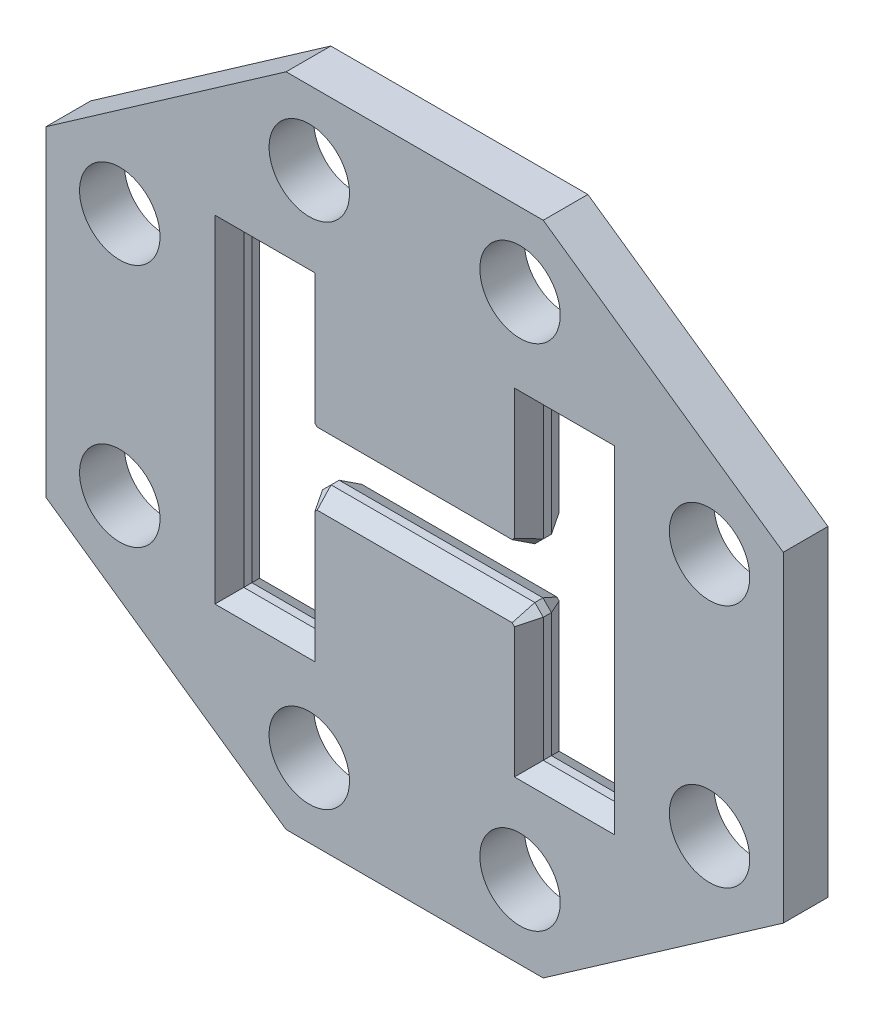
SolidWorks part; units mm, degrees
ref_plane "Front Plane" through (0, 0, 0) normal (1, 0, 0) x (0, 1, 0)
ref_plane "Top Plane" through (0, 0, 0) normal (0, 0, 1) x (0, 1, 0)
ref_plane "Right Plane" through (0, 0, 0) normal (0, 1, 0) x (-1, 0, 0)
sketch "sk W14x730" plane through (0, 0, 0) normal (0, 0, 1) x (0, 1, 0)
  point P0 (0, -284.734)
  point P1 (-38.989, 0)
  line B0 (-227.203, -284.734) -> (-227.203, -160.02)
  line B1 (-227.203, -160.02) -> (-54.229, -160.02)
  line B2 (-38.989, -144.78) -> (-38.989, 144.78)
  line B3 (-54.229, 160.02) -> (-227.203, 160.02)
  line B4 (-227.203, 160.02) -> (-227.203, 284.734)
  line B5 (-227.203, 284.734) -> (227.203, 284.734)
  line B6 (227.203, 284.734) -> (227.203, 160.02)
  line B7 (227.203, 160.02) -> (54.229, 160.02)
  line B8 (38.989, 144.78) -> (38.989, -144.78)
  line B9 (54.229, -160.02) -> (227.203, -160.02)
  line B10 (227.203, -160.02) -> (227.203, -284.734)
  line B11 (227.203, -284.734) -> (-227.203, -284.734)
  arc B12 (-54.229, -160.02) -> (-38.989, -144.78) centre (-54.229, -144.78) ccw
  arc B13 (-38.989, 144.78) -> (-54.229, 160.02) centre (-54.229, 144.78) ccw
  arc B14 (54.229, 160.02) -> (38.989, 144.78) centre (54.229, 144.78) ccw
  arc B15 (38.989, -144.78) -> (54.229, -160.02) centre (54.229, -144.78) ccw
sketch_block_instance "W14x730-113"
sketch_block "W14x730" parameters "D4"=15.24, "D1"=454.406, "D2"=569.468, "D3"=77.978, "D5"=124.714
sketch_block_instance "W14x730-232"
sketch_block_instance "W14x730-233"
sketch_block_instance "W14x730-234"
sketch_block_instance "W14x730-276"
sketch_block_instance "W14x730-277"
sketch_block_instance "W14x730-278"
sketch_block_instance "W14x730-279"
sketch_block_instance "W14x730-280"
sketch_block_instance "W14x730-281"
sketch_block_instance "W14x730-282"
sketch_block_instance "W14x730-283"
sketch_block_instance "W14x730-284"
sketch_block_instance "W14x730-285"
sketch_block_instance "W14x730-286"
sketch_block_instance "W14x730-287"
sketch_block_instance "W14x730-288"
sketch_block_instance "W14x730-289"
sketch_block_instance "W14x730-321"
sketch_block_instance "W14x730-322"
sketch_block_instance "W14x730-323"
sketch_block_instance "W14x730-324"
sketch_block_instance "W14x730-325"
sketch_block_instance "W14x730-326"
sketch_block_instance "W14x730-327"
sketch_block_instance "W14x730-328"
sketch_block_instance "W14x730-329"
sketch_block_instance "W14x730-330"
sketch_block_instance "W14x730-331"
sketch_block_instance "W14x730-332"
sketch_block_instance "W14x730-333"
sketch_block_instance "W14x730-334"
sketch_block_instance "W14x730-335"
sketch_block_instance "W14x730-336"
sketch_block_instance "W14x730-337"
sketch_block_instance "W14x730-338"
sketch_block_instance "W14x730-339"
sketch_block_instance "W14x730-340"
sketch_block_instance "W14x730-341"
sketch_block_instance "W14x730-365"
sketch_block_instance "W14x730-366"
sketch_block_instance "W14x730-367"
sketch_block_instance "W14x730-368"
sketch_block_instance "W14x730-369"
sketch_block_instance "W14x730-370"
sketch_block_instance "W14x730-371"
sketch_block_instance "W14x730-372"
sketch_block_instance "W14x730-373"
sketch_block_instance "W14x730-374"
sketch_block_instance "W14x730-375"
sketch_block_instance "W14x730-376"
sketch_block_instance "W14x730-377"
sketch_block_instance "W14x730-378"
sketch_block_instance "W14x730-379"
sketch_block_instance "W14x730-380"
sketch_block_instance "W14x730-381"
sketch_block_instance "W14x730-382"
sketch_block_instance "W14x730-383"
sketch_block_instance "W14x730-384"
sketch_block_instance "W14x730-385"
sketch_block_instance "W14x730-386"
sketch_block_instance "W14x730-387"
sketch_block_instance "W14x730-388"
sketch_block_instance "W14x730-389"
sketch_block_instance "W14x730-390"
sketch_block_instance "W14x730-391"
sketch_block_instance "W14x730-410"
sketch_block_instance "W14x730-411"
sketch_block_instance "W14x730-412"
sketch_block_instance "W14x730-413"
sketch_block_instance "W14x730-414"
sketch_block_instance "W14x730-415"
sketch_block_instance "W14x730-416"
sketch_block_instance "W14x730-417"
sketch_block_instance "W14x730-418"
sketch_block_instance "W14x730-419"
sketch_block_instance "W14x730-420"
sketch_block_instance "W14x730-421"
sketch_block_instance "W14x730-422"
sketch_block_instance "W14x730-423"
sketch_block_instance "W14x730-424"
sketch_block_instance "W14x730-425"
sketch_block_instance "W14x730-426"
sketch_block_instance "W14x730-427"
sketch_block_instance "W14x730-428"
sketch_block_instance "W14x730-429"
sketch_block_instance "W14x730-430"
sketch_block_instance "W14x730-431"
sketch_block_instance "W14x730-432"
sketch_block_instance "W14x730-433"
sketch_block_instance "W14x730-434"
sketch_block_instance "W14x730-435"
sketch_block_instance "W14x730-436"
sketch_block_instance "W14x730-437"
sketch_block_instance "W14x730-438"
sketch_block_instance "W14x730-439"
sketch_block_instance "W14x730-440"
sketch_block_instance "W14x730-443"
sketch_block_instance "W14x730-454"
sketch_block_instance "W14x730-455"
sketch_block_instance "W14x730-456"
sketch_block_instance "W14x730-457"
sketch_block_instance "W14x730-458"
sketch_block_instance "W14x730-459"
sketch_block_instance "W14x730-460"
sketch_block_instance "W14x730-461"
sketch_block_instance "W14x730-462"
sketch_block_instance "W14x730-463"
sketch_block_instance "W14x730-464"
sketch_block_instance "W14x730-465"
sketch_block_instance "W14x730-466"
sketch_block_instance "W14x730-467"
sketch_block_instance "W14x730-468"
sketch_block_instance "W14x730-469"
sketch_block_instance "W14x730-470"
sketch_block_instance "W14x730-471"
sketch_block_instance "W14x730-472"
sketch_block_instance "W14x730-473"
sketch_block_instance "W14x730-474"
sketch_block_instance "W14x730-475"
sketch_block_instance "W14x730-476"
sketch_block_instance "W14x730-477"
sketch_block_instance "W14x730-478"
sketch_block_instance "W14x730-479"
sketch_block_instance "W14x730-480"
sketch_block_instance "W14x730-481"
sketch_block_instance "W14x730-482"
sketch_block_instance "W14x730-483"
sketch_block_instance "W14x730-484"
sketch_block_instance "W14x730-485"
sketch_block_instance "W14x730-486"
sketch_block_instance "W14x730-487"
sketch_block_instance "W14x730-488"
sketch_block_instance "W14x730-489"
sketch_block_instance "W14x730-490" parameters "D1"=817.9177, "D2"=1027.7361, "D3"=0.4058, "D4"=24.0009, "D5"=0.4058, "D6"=533.4, "D7"=27.3509, "D8"=8374.3758, "D9"=3499.6788, "D10"=18059.4
sketch "sk W14x665" plane through (0, 0, 0) normal (0, 0, 1) x (0, 1, 0)
  point P0 (-224.155, -274.828)
  line B0 (-224.155, -274.828) -> (-224.155, -160.02)
  line B1 (-224.155, -160.02) -> (-51.181, -160.02)
  line B2 (-35.941, -144.78) -> (-35.941, 144.78)
  line B3 (-51.181, 160.02) -> (-224.155, 160.02)
  line B4 (-224.155, 160.02) -> (-224.155, 274.828)
  line B5 (-224.155, 274.828) -> (224.155, 274.828)
  line B6 (224.155, 274.828) -> (224.155, 160.02)
  line B7 (224.155, 160.02) -> (51.181, 160.02)
  line B8 (35.941, 144.78) -> (35.941, -144.78)
  line B9 (51.181, -160.02) -> (224.155, -160.02)
  line B10 (224.155, -160.02) -> (224.155, -274.828)
  line B11 (224.155, -274.828) -> (-224.155, -274.828)
  arc B12 (-51.181, -160.02) -> (-35.941, -144.78) centre (-51.181, -144.78) ccw
  arc B13 (-35.941, 144.78) -> (-51.181, 160.02) centre (-51.181, 144.78) ccw
  arc B14 (51.181, 160.02) -> (35.941, 144.78) centre (51.181, 144.78) ccw
  arc B15 (35.941, -144.78) -> (51.181, -160.02) centre (51.181, -144.78) ccw
sketch_block_instance "W14x665-1"
sketch_block "W14x665" parameters "D4"=15.24, "D1"=448.31, "D2"=549.656, "D3"=71.882, "D5"=114.808, "D6"=6.35
sketch "sk 605" plane through (0, 0, 0) normal (0, 0, 1) x (0, 1, 0)
  point P0 (-221.1705, -265.684)
  line B0 (-221.1705, -265.684) -> (-221.1705, -160.02)
  line B1 (-221.1705, -160.02) -> (-48.1965, -160.02)
  line B2 (-32.9565, -144.78) -> (-32.9565, 144.78)
  line B3 (-48.1965, 160.02) -> (-221.1705, 160.02)
  line B4 (-221.1705, 160.02) -> (-221.1705, 265.684)
  line B5 (-221.1705, 265.684) -> (221.1705, 265.684)
  line B6 (221.1705, 265.684) -> (221.1705, 160.02)
  line B7 (221.1705, 160.02) -> (48.1965, 160.02)
  line B8 (32.9565, 144.78) -> (32.9565, -144.78)
  line B9 (48.1965, -160.02) -> (221.1705, -160.02)
  line B10 (221.1705, -160.02) -> (221.1705, -265.684)
  line B11 (221.1705, -265.684) -> (-221.1705, -265.684)
  arc B12 (-48.1965, -160.02) -> (-32.9565, -144.78) centre (-48.1965, -144.78) ccw
  arc B13 (-32.9565, 144.78) -> (-48.1965, 160.02) centre (-48.1965, 144.78) ccw
  arc B14 (48.1965, 160.02) -> (32.9565, 144.78) centre (48.1965, 144.78) ccw
  arc B15 (32.9565, -144.78) -> (48.1965, -160.02) centre (48.1965, -144.78) ccw
sketch_block_instance "w14x605-2"
sketch_block "w14x605" parameters "D4"=15.24, "D1"=442.341, "D2"=531.368, "D3"=65.913, "D5"=105.664, "D6"=6.35
sketch "sk 4\" hex nut Pattern" plane through (0, 0, 0) normal (0, 0, 1) x (0, 1, 0)
  line L7 (419.0803, -173.5887) -> (419.0803, 173.5887)
  line L8 (419.0803, 173.5887) -> (173.5887, 419.0803)
  line L9 (173.5887, 419.0803) -> (-173.5887, 419.0803)
  line L10 (-173.5887, 419.0803) -> (-419.0803, 173.5887)
  line L11 (-419.0803, 173.5887) -> (-419.0803, -173.5887)
  line L12 (-419.0803, -173.5887) -> (-173.5887, -419.0803)
  line L13 (-173.5887, -419.0803) -> (173.5887, -419.0803)
  line L14 (173.5887, -419.0803) -> (419.0803, -173.5887)
  line L29 (54.229, -125.02) -> (262.203, -125.02)
  line L30 (262.203, -125.02) -> (262.203, -319.734)
  line L31 (-262.203, -125.02) -> (-54.229, -125.02)
  line L32 (-262.203, -319.734) -> (-262.203, -125.02)
  line L33 (262.203, -319.734) -> (-262.203, -319.734)
  line L34 (54.229, -125.02) -> (262.203, -125.02)
  line L35 (262.203, -125.02) -> (262.203, -319.734)
  line L36 (-262.203, -125.02) -> (-54.229, -125.02)
  line L37 (-262.203, -319.734) -> (-262.203, -125.02)
  line L38 (262.203, -319.734) -> (-262.203, -319.734)
  line L39 (-419.0803, 173.5887) -> (419.0803, -173.5887)
  line L40 (419.0803, 173.5887) -> (-419.0803, -173.5887)
  line L42 (-466.3243, 523.8553) -> (466.3243, 523.8553)
  line L43 (-466.3243, 523.8553) -> (-466.3243, -523.8553)
  line L44 (262.203, 125.02) -> (54.229, 125.02)
  line L45 (262.203, 319.734) -> (262.203, 125.02)
  line L46 (-262.203, 319.734) -> (262.203, 319.734)
  line L47 (-262.203, 125.02) -> (-262.203, 319.734)
  line L48 (-54.229, 125.02) -> (-262.203, 125.02)
  line L49 (262.203, 125.02) -> (54.229, 125.02)
  line L50 (262.203, 319.734) -> (262.203, 125.02)
  line L51 (-262.203, 319.734) -> (262.203, 319.734)
  line L52 (-262.203, 125.02) -> (-262.203, 319.734)
  line L53 (-54.229, 125.02) -> (-262.203, 125.02)
  line L54 (-466.3243, -523.8553) -> (466.3243, -523.8553)
  line L55 (466.3243, 523.8553) -> (466.3243, -523.8553)
  circle A0 centre (0, 0) radius 419.0803 construction
  line B0 (-128.6781, -496.8678) -> (-83.7675, -419.0803)
  circle B1 centre (-173.5887, -419.0803) radius 77.7875 construction
  circle B2 centre (-173.5887, -419.0803) radius 50.8
  circle B3 centre (-173.5887, -419.0803) radius 89.8213
  circle B4 centre (-173.5887, -419.0803) radius 99.3463
  line B5 (-83.7675, 419.0803) -> (-128.6781, 496.8678)
  line B6 (-128.6781, 496.8678) -> (-218.4994, 496.8678)
  line B7 (-218.4994, 496.8678) -> (-263.41, 419.0803)
  line B8 (-263.41, 419.0803) -> (-218.4994, 341.2928)
  line B9 (-218.4994, 341.2928) -> (-128.6781, 341.2928)
  circle B10 centre (-173.5887, 419.0803) radius 77.7875 construction
  circle B11 centre (-173.5887, 419.0803) radius 50.8
  circle B12 centre (-173.5887, 419.0803) radius 89.8213
  circle B13 centre (-173.5887, 419.0803) radius 99.3463
  line B14 (263.41, 419.0803) -> (218.4994, 496.8678)
  line B15 (218.4994, 496.8678) -> (128.6781, 496.8678)
  line B16 (128.6781, 496.8678) -> (83.7675, 419.0803)
  line B17 (128.6781, 341.2928) -> (218.4994, 341.2928)
  line B18 (218.4994, 341.2928) -> (263.41, 419.0803)
  circle B19 centre (173.5887, 419.0803) radius 50.8
  circle B20 centre (173.5887, 419.0803) radius 89.8213
  circle B21 centre (173.5887, 419.0803) radius 99.3463
  line B22 (263.41, -419.0803) -> (218.4994, -341.2928)
  line B23 (218.4994, -341.2928) -> (128.6781, -341.2928)
  line B24 (83.7675, -419.0803) -> (128.6781, -496.8678)
  line B25 (128.6781, -496.8678) -> (218.4994, -496.8678)
  line B26 (218.4994, -496.8678) -> (263.41, -419.0803)
  circle B27 centre (173.5887, -419.0803) radius 77.7875 construction
  circle B28 centre (173.5887, -419.0803) radius 50.8
  circle B29 centre (173.5887, -419.0803) radius 89.8213
  circle B30 centre (173.5887, -419.0803) radius 99.3463
  line B31 (-271.728, 149.7586) -> (-316.6386, 227.5461)
  line B32 (-316.6386, 227.5461) -> (-406.4599, 227.5461)
  line B33 (-406.4599, 227.5461) -> (-451.3705, 149.7586)
  line B34 (-451.3705, 149.7586) -> (-406.4599, 71.9711)
  line B35 (-406.4599, 71.9711) -> (-316.6386, 71.9711)
  circle B36 centre (-361.5493, 149.7586) radius 77.7875 construction
  circle B37 centre (-361.5493, 149.7586) radius 50.8
  circle B38 centre (-361.5493, 149.7586) radius 89.8213
  circle B39 centre (-361.5493, 149.7586) radius 99.3463
  line B40 (-271.728, -149.7586) -> (-316.6386, -71.9711)
  line B41 (-316.6386, -71.9711) -> (-406.4599, -71.9711)
  line B42 (-406.4599, -71.9711) -> (-451.3705, -149.7586)
  line B43 (-451.3705, -149.7586) -> (-406.4599, -227.5461)
  line B44 (-406.4599, -227.5461) -> (-316.6386, -227.5461)
  line B45 (-316.6386, -227.5461) -> (-271.728, -149.7586)
  circle B46 centre (-361.5493, -149.7586) radius 77.7875 construction
  circle B47 centre (-361.5493, -149.7586) radius 50.8
  circle B48 centre (-361.5493, -149.7586) radius 89.8213
  circle B49 centre (-361.5493, -149.7586) radius 99.3463
  line B50 (451.3705, 149.7586) -> (406.4599, 227.5461)
  line B51 (406.4599, 227.5461) -> (316.6386, 227.5461)
  line B52 (316.6386, 227.5461) -> (271.728, 149.7586)
  line B53 (316.6386, 71.9711) -> (406.4599, 71.9711)
  circle B54 centre (361.5493, 149.7586) radius 77.7875 construction
  circle B55 centre (361.5493, 149.7586) radius 50.8
  circle B56 centre (361.5493, 149.7586) radius 89.8213
  circle B57 centre (361.5493, 149.7586) radius 99.3463
  line B58 (316.6386, -71.9711) -> (271.728, -149.7586)
  line B59 (406.4599, -227.5461) -> (451.3705, -149.7586)
  circle B60 centre (361.5493, -149.7586) radius 77.7875 construction
  circle B61 centre (361.5493, -149.7586) radius 50.8
  circle B62 centre (361.5493, -149.7586) radius 89.8213
  circle B63 centre (361.5493, -149.7586) radius 99.3463
sketch_block_instance "4\" hex nut-1"
sketch_block "4\" hex nut" parameters "D1"=155.575, "D2"=101.6, "D3"=9.525
sketch_block_instance "4\" hex nut-2"
sketch_block_instance "4\" hex nut-3"
sketch_block_instance "4\" hex nut-4"
sketch_block_instance "4\" hex nut-5"
sketch_block_instance "4\" hex nut-6"
sketch_block_instance "4\" hex nut-7"
sketch_block_instance "4\" hex nut-8" parameters "D1"=129.9071, "D2"=77.383, "D3"=138.8929, "D4"=187.7059, "D5"=195.0068, "D6"=231.3326
sketch "Sketch3" plane through (0, 0, 0) normal (0, 0, 1) x (0, 1, 0)
  line L0 (-466.3243, 523.8553) -> (466.3243, 523.8553) construction
  line L1 (466.3243, 523.8553) -> (466.3243, -523.8553) construction
  line L2 (-466.3243, -523.8553) -> (466.3243, -523.8553) construction
  line L3 (-466.3243, 523.8553) -> (-466.3243, -523.8553) construction
  line L4 (228.2342, 523.8553) -> (466.3243, 182.7049)
  line L5 (466.3243, 182.7049) -> (466.3243, -182.7049)
  line L6 (466.3243, -182.7049) -> (228.2342, -523.8553)
  line L7 (228.2342, -523.8553) -> (-228.2342, -523.8553)
  line L8 (-228.2342, -523.8553) -> (-466.3243, -182.7049)
  line L9 (-466.3243, -182.7049) -> (-466.3243, 182.7049)
  line L10 (-466.3243, 182.7049) -> (-228.2342, 523.8553)
  line L11 (-228.2342, 523.8553) -> (228.2342, 523.8553)
  line L93 (-54.229, 156.845) -> (-230.378, 156.845)
  line L94 (-230.378, 156.845) -> (-230.378, 287.909)
  line L95 (230.378, 156.845) -> (54.229, 156.845)
  line L96 (230.378, 287.909) -> (230.378, 156.845)
  line L97 (-230.378, 287.909) -> (230.378, 287.909)
  line L98 (-54.229, 156.845) -> (-230.378, 156.845)
  line L99 (-230.378, 156.845) -> (-230.378, 287.909)
  line L100 (230.378, 156.845) -> (54.229, 156.845)
  line L101 (230.378, 287.909) -> (230.378, 156.845)
  line L102 (-230.378, 287.909) -> (230.378, 287.909)
  line L118 (54.229, -156.845) -> (230.378, -156.845)
  line L119 (230.378, -156.845) -> (230.378, -287.909)
  line L120 (230.378, -287.909) -> (-230.378, -287.909)
  line L121 (-230.378, -287.909) -> (-230.378, -156.845)
  line L122 (-230.378, -156.845) -> (-54.229, -156.845)
  line L123 (54.229, -156.845) -> (230.378, -156.845)
  line L124 (230.378, -156.845) -> (230.378, -287.909)
  line L125 (230.378, -287.909) -> (-230.378, -287.909)
  line L126 (-230.378, -287.909) -> (-230.378, -156.845)
  line L127 (-230.378, -156.845) -> (-54.229, -156.845)
  line L130 (42.164, 144.78) -> (42.164, -144.78)
  line L131 (42.164, 144.78) -> (42.164, -144.78)
  line L132 (-54.229, 156.845) -> (-42.164, 144.78)
  line L133 (-42.164, -144.78) -> (-42.164, 144.78)
  line L134 (-42.164, -144.78) -> (-42.164, 144.78)
  line L135 (42.164, 144.78) -> (54.229, 156.845)
  line L136 (42.164, -144.78) -> (54.229, -156.845)
  line L137 (-54.229, -156.845) -> (-42.164, -144.78)
  circle A0 centre (173.5887, 419.0803) radius 104.775 construction
  circle A1 centre (-173.5887, 419.0803) radius 104.775 construction
  circle A2 centre (-361.5493, 149.7586) radius 104.775 construction
  circle A3 centre (-361.5493, -149.7586) radius 104.775 construction
  circle A4 centre (-173.5887, -419.0803) radius 104.775 construction
  circle A5 centre (173.5887, -419.0803) radius 104.775 construction
  circle A6 centre (361.5493, -149.7586) radius 104.775 construction
  circle A7 centre (361.5493, 149.7586) radius 104.775 construction
  dimension "D1" = 3.175
  dimension "D2" = 3.175
  dimension "D3" = 3.175
  dimension "D4" = 3.175
extrude "Main Plate" add sketch "Sketch3" along normal mid plane 63.5
sketch "Sketch7" plane through (0, 0, 0) normal (0, 0, 1) x (0, 1, 0)
  line L13 (-224.3455, -268.859) -> (-224.3455, -156.845)
  line L14 (-224.3455, -156.845) -> (-48.1965, -156.845)
  line L15 (224.3455, -156.845) -> (224.3455, -268.859)
  line L16 (224.3455, -268.859) -> (-224.3455, -268.859)
  line L17 (48.1965, -156.845) -> (224.3455, -156.845)
  line L18 (-224.3455, -268.859) -> (-224.3455, -156.845)
  line L19 (-224.3455, -156.845) -> (-48.1965, -156.845)
  line L20 (224.3455, -156.845) -> (224.3455, -268.859)
  line L21 (224.3455, -268.859) -> (-224.3455, -268.859)
  line L22 (48.1965, -156.845) -> (224.3455, -156.845)
  line L33 (224.3455, 156.845) -> (48.1965, 156.845)
  line L34 (224.3455, 268.859) -> (224.3455, 156.845)
  line L35 (-224.3455, 268.859) -> (224.3455, 268.859)
  line L36 (-224.3455, 156.845) -> (-224.3455, 268.859)
  line L37 (-48.1965, 156.845) -> (-224.3455, 156.845)
  line L38 (224.3455, 156.845) -> (48.1965, 156.845)
  line L39 (224.3455, 268.859) -> (224.3455, 156.845)
  line L40 (-224.3455, 268.859) -> (224.3455, 268.859)
  line L41 (-224.3455, 156.845) -> (-224.3455, 268.859)
  line L42 (-48.1965, 156.845) -> (-224.3455, 156.845)
  line L55 (36.1315, 144.78) -> (36.1315, -144.78)
  line L60 (36.1315, 144.78) -> (36.1315, -144.78)
  line L61 (-242.3311, 298.7357) -> (246.0967, 298.7357)
  line L62 (-242.3311, 298.7357) -> (-242.3311, -298.6887)
  line L63 (-242.3311, -298.6887) -> (246.0967, -298.6887)
  line L64 (246.0967, 298.7357) -> (246.0967, -298.6887)
  line L65 (-48.1965, 156.845) -> (-36.1315, 144.78)
  line L66 (-36.1315, -144.78) -> (-36.1315, 144.78)
  line L67 (-36.1315, -144.78) -> (-36.1315, 144.78)
  line L68 (36.1315, 144.78) -> (48.1965, 156.845)
  line L69 (36.1315, -144.78) -> (48.1965, -156.845)
  line L70 (-48.1965, -156.845) -> (-36.1315, -144.78)
  dimension "D1" = 3.175
  dimension "D2" = 3.175
  dimension "D3" = 3.175
  dimension "D4" = 3.175
extrude "W605" add sketch "Sketch7" along normal mid plane 63.5
sketch "Sketch5" plane through (0, 0, 0) normal (0, 0, 1) x (0, 1, 0)
  circle A0 centre (-173.5887, 419.0803) radius 57.15
  circle A1 centre (173.5887, 419.0803) radius 57.15
  circle A2 centre (361.5493, 149.7586) radius 57.15
  circle A3 centre (361.5493, -149.7586) radius 57.15
  circle A4 centre (173.5887, -419.0803) radius 57.15
  circle A5 centre (-173.5887, -419.0803) radius 57.15
  circle A6 centre (-361.5493, -149.7586) radius 57.15
  circle A7 centre (-361.5493, 149.7586) radius 57.15
  dimension "D1" = 114.3
  dimension "D2" = 114.3
  dimension "D3" = 114.3
  dimension "D4" = 114.3
  dimension "D5" = 114.3
  dimension "D6" = 114.3
  dimension "D7" = 114.3
  dimension "D8" = 114.3
extrude "Cut-Extrude1" cut sketch "Sketch5" against normal through all both and the other way through all
chamfer "Chamfer1" distance 15 angle 60 16 edges at (156.845, -136.271, 31.75) (156.845, 136.271, 31.75) (-156.845, -136.271, 31.75) (-156.845, 136.271, 31.75) (212.852, -224.3455, 31.75) (268.859, 0, 31.75) (212.852, 224.3455, 31.75) (150.8125, 42.164, 31.75) (0, 36.1315, 31.75) (-150.8125, 42.164, 31.75) (-212.852, 224.3455, 31.75) (-268.859, 0, 31.75) (-212.852, -224.3455, 31.75) (-150.8125, -42.164, 31.75) (0, -36.1315, 31.75) (150.8125, -42.164, 31.75)
chamfer "Chamfer2" distance 15 angle 60 16 edges at (-156.845, 136.271, -31.75) (-156.845, -136.271, -31.75) (156.845, -136.271, -31.75) (156.845, 136.271, -31.75) (0, -36.1315, -31.75) (-212.852, -224.3455, -31.75) (-268.859, 0, -31.75) (-212.852, 224.3455, -31.75) (0, 36.1315, -31.75) (212.852, 224.3455, -31.75) (268.859, 0, -31.75) (212.852, -224.3455, -31.75) (-150.8125, -42.164, -31.75) (-150.8125, 42.164, -31.75) (150.8125, 42.164, -31.75) (150.8125, -42.164, -31.75)
